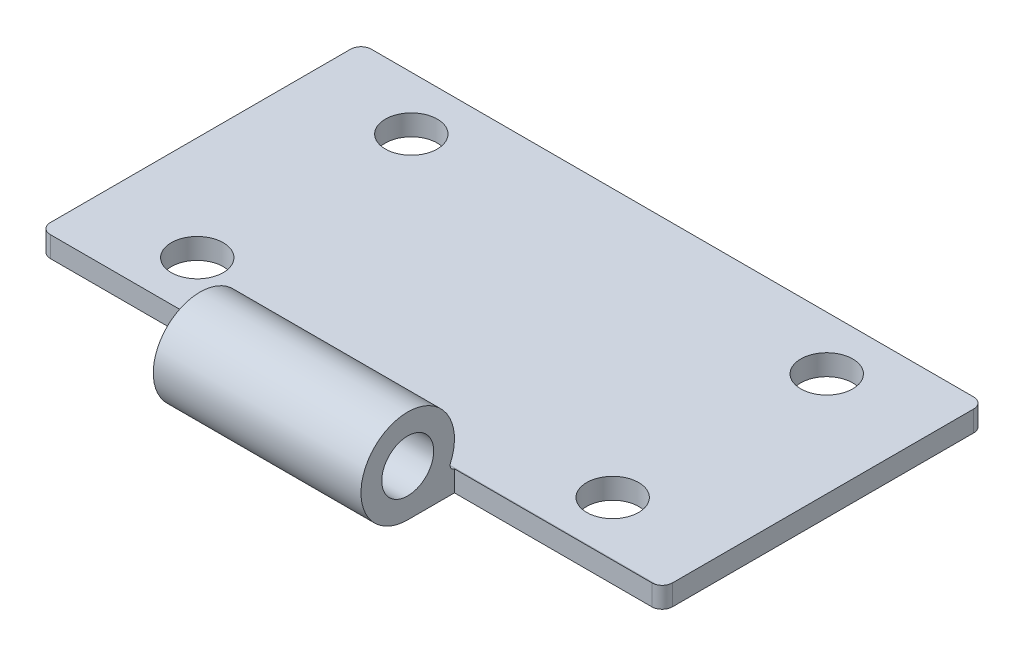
SolidWorks part; units mm, degrees
other "Markup1"
sketch "Sketch4" plane through (0, 0, -208.805) normal (-0.9952, -0.0019, 0.0982) x (-0.0754, 0.6551, -0.7518)
ref_plane "Front Plane" through (0, 0, 0) normal (0, 0, 1) x (1, 0, 0)
ref_plane "Top Plane" through (0, 0, 0) normal (0, 1, 0) x (1, 0, 0)
ref_plane "Right Plane" through (0, 0, 0) normal (1, 0, 0) x (0, 0, -1)
sketch "Sketch1" plane through (0, 0, 0) normal (1, 0, 0) x (0, 0, -1)
  line L0 (248.805, 0) -> (213.305, 0)
  line L1 (248.805, 2) -> (217.8876, 2)
  line L2 (248.805, 0) -> (248.805, 2)
  line L5 (248.805, 2) -> (208.805, 2) construction
  line L6 (248.805, 0) -> (208.805, 0) construction
  circle A0 centre (213.305, 4.5) radius 2.5
  arc A1 (217.4294, 2.7) -> (213.305, 0) centre (213.305, 4.5) ccw
  circle A2 centre (213.305, 4.5) radius 4.5 construction
  arc A3 (217.4294, 2.7) -> (217.8876, 2) centre (217.8876, 2.5) ccw
  dimension "D3" = 5
  dimension "D1" = 0.5
  dimension "D2" = 2
  dimension "D4" = 2
extrude "Boss-Extrude1" add sketch "Sketch1" along normal blind 60
sketch "Sketch2" plane through (0, 0, 0) normal (0, 1, 0) x (1, 0, 0)
  line L1 (0, 208.805) -> (20, 208.805)
  line L2 (0, 208.805) -> (0, 217.8876)
  line L3 (0, 217.8876) -> (20, 217.8876)
  line L4 (20, 208.805) -> (20, 217.8876)
  line L5 (60, 217.8876) -> (0, 217.8876) construction
  line L7 (60, 217.805) -> (40, 217.805)
  line L8 (60, 217.805) -> (60, 208.805)
  line L9 (60, 208.805) -> (40, 208.805)
  line L10 (40, 217.805) -> (40, 208.805)
  line L11 (0, 208.805) -> (60, 208.805) construction
  dimension "D1" = 9.0826
  dimension "D2" = 20
  dimension "D3" = 9
  dimension "D4" = 20
extrude "Cut-Extrude1" cut sketch "Sketch2" along normal blind 60
sketch "Sketch3" plane through (0, 2, 0) normal (0, 1, 0) x (1, 0, 0)
  line L0 (0, 248.805) -> (60, 217.8876) construction
  line L1 (60, 248.805) -> (0, 217.8876) construction
  line L3 (10, 243.6521) -> (50, 243.6521) construction
  line L4 (10, 243.6521) -> (10, 223.0405) construction
  line L5 (10, 223.0405) -> (50, 223.0405) construction
  line L6 (50, 243.6521) -> (50, 223.0405) construction
  line L7 (30, 223.0405) -> (30, 243.6521) construction
  line L8 (10, 233.3463) -> (50, 233.3463) construction
  circle A0 centre (10, 243.6521) radius 2.5
  circle A1 centre (10, 223.0405) radius 2.5
  circle A2 centre (50, 223.0405) radius 2.5
  circle A3 centre (50, 243.6521) radius 2.5
  point P8 (30, 233.3463)
  dimension "D3" = 5
  dimension "D1" = 20.6116
  dimension "D2" = 40
extrude "Cut-Extrude2" cut sketch "Sketch3" against normal blind 60
fillet "Fillet1" radius 1 4 edges at (0, 1, -217.8876) (0, 1, -248.805) (60, 1, -248.805) (60, 1.0034, -217.805)
